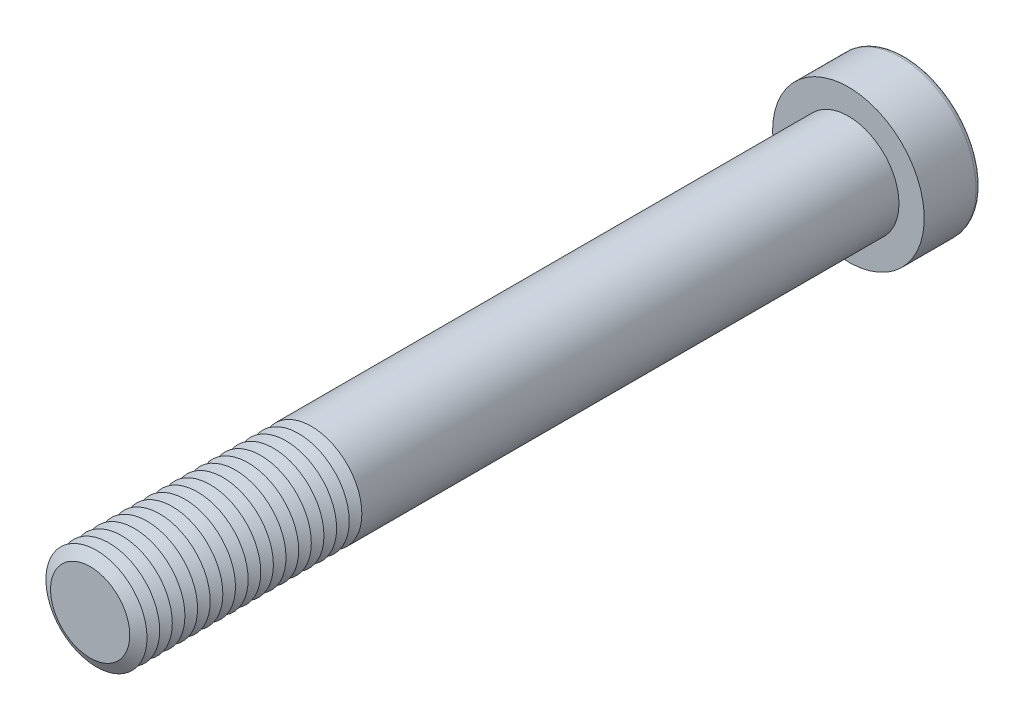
SolidWorks part; units mm, degrees
ref_plane "Front Plane" through (0, 0, 0) normal (0, 0, 1) x (1, 0, 0)
ref_plane "Top Plane" through (0, 0, 0) normal (0, 1, 0) x (1, 0, 0)
ref_plane "Right Plane" through (0, 0, 0) normal (1, 0, 0) x (0, 0, -1)
sketch "Sketch1" plane through (0, 0, 0) normal (0, 0, 1) x (1, 0, 0)
  circle A0 centre (0, 0) radius 8
  dimension "D1" = 16
extrude "Boss-Extrude1" add sketch "Sketch1" along normal blind 120
sketch "Sketch2" plane through (0, 0, 0) normal (0, 0, -1) x (-1, 0, 0)
  circle A0 centre (0, 0) radius 12
  dimension "D1" = 24
extrude "Boss-Extrude2" add sketch "Sketch2" along normal blind 9
sketch "Sketch3" plane through (0, 0, -9) normal (0, 0, -1) x (-1, 0, 0)
  line L1 (-3.4641, 6) -> (-6.9282, 0)
  line L2 (-6.9282, 0) -> (-3.4641, -6)
  line L3 (-3.4641, -6) -> (3.4641, -6)
  line L4 (3.4641, -6) -> (6.9282, 0)
  line L5 (6.9282, 0) -> (3.4641, 6)
  line L6 (3.4641, 6) -> (-3.4641, 6)
  circle A0 centre (0, 0) radius 6 construction
  dimension "D1" = 12
extrude "Cut-Extrude1" cut sketch "Sketch3" against normal blind 9
fillet "Fillet1" radius 0.8 1 edges at (-12, 0, -9)
sketch "Sketch4" plane through (0, 0, 0) normal (0, 0, -1) x (-1, 0, 0)
  line L0 (3.4641, -6) -> (6.9282, 0) construction
  circle A0 centre (0, 0) radius 6
extrude "Cut-Extrude2" cut sketch "Sketch4" against normal through all draft 60
sketch "Sketch5" plane through (0, 0, -9) normal (0, 0, -1) x (-1, 0, 0)
  circle A0 centre (0, 0) radius 6.9282
extrude "Cut-Extrude3" cut sketch "Sketch5" against normal through all draft 75
sketch "Sketch7" plane through (0, 0, 0) normal (1, 0, 0) x (0, 0, -1)
  line L25 (-120, 6.2679) -> (-119, 8)
  line L26 (-120, 8) -> (-120, -8) construction
  line L27 (-119, 8) -> (-121, 8)
  line L28 (-121, 8) -> (-120, 6.2679)
  line L29 (0, 8) -> (-120, 8) construction
  dimension "D1" = 2
revolve "Cut-Revolve1" cut sketch "Sketch7" angle 360 about axis through (0, 0, 120) along (0, 0, -1)
pattern_linear "LPattern1" count 18 spacing 2 along (0, 0, -1) of "Cut-Revolve1"
